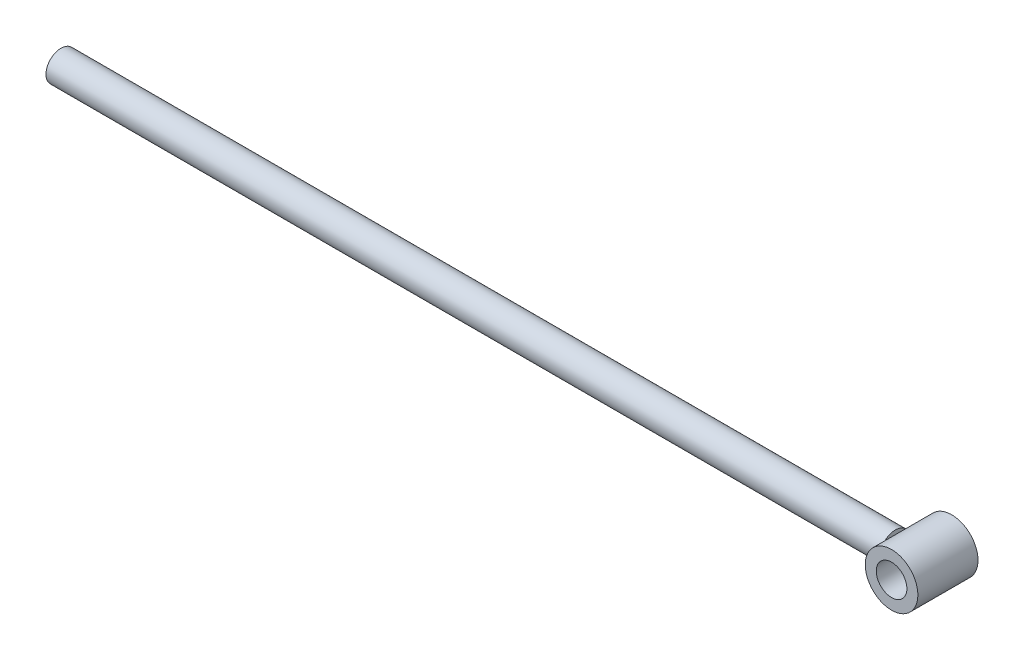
SolidWorks part; units mm, degrees
ref_plane "Plan de face" through (0, 0, 0) normal (0, 0, 1) x (1, 0, 0)
ref_plane "Plan de dessus" through (0, 0, 0) normal (0, 1, 0) x (1, 0, 0)
ref_plane "Plan de droite" through (0, 0, 0) normal (1, 0, 0) x (0, 0, -1)
sketch "Esquisse1" plane through (0, 0, 0) normal (1, 0, 0) x (0, 0, -1)
  circle A0 centre (0, 0) radius 10
  dimension "D1" = 20
extrude "Extrusion1" add sketch "Esquisse1" along normal blind 555
sketch "Esquisse2" plane through (0, 0, 0) normal (0, 0, 1) x (1, 0, 0)
  line L0 (555, -10) -> (555, 10) construction
  circle A0 centre (572.5, 0) radius 17.5
  circle A1 centre (572.5, 0) radius 10.2
  dimension "D1" = 20.4
  dimension "D2" = 35
extrude "Extrusion2" add sketch "Esquisse2" along normal mid plane 40
ref_plane "Plan1" through (542, 0, 0) normal (1, 0, 0) x (0, 0, -1)
